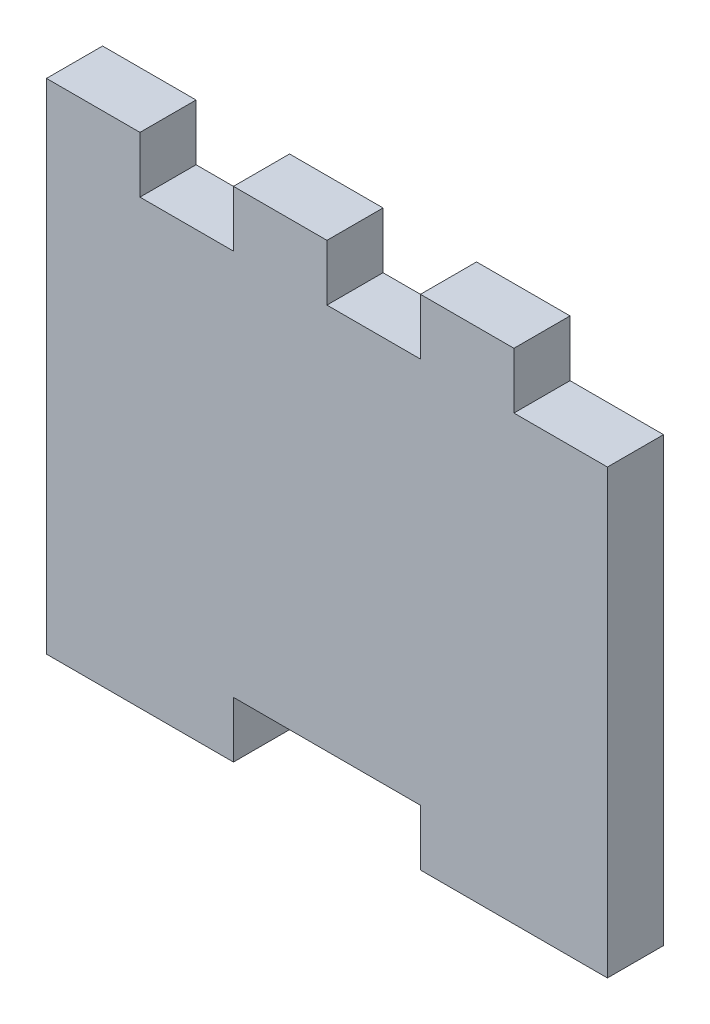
SolidWorks part; units mm, degrees
ref_plane "Спереди" through (0, 0, 0) normal (0, 0, 1) x (1, 0, 0)
ref_plane "Сверху" through (0, 0, 0) normal (0, 1, 0) x (1, 0, 0)
ref_plane "Справа" through (0, 0, 0) normal (1, 0, 0) x (0, 0, -1)
sketch "Эскиз1" plane through (0, 0, 0) normal (0, 0, 1) x (1, 0, 0)
  line L0 (-141.6213, 98.526) -> (-141.6213, 178.526)
  line L1 (-51.6213, 98.526) -> (-51.6213, 169.526)
  line L2 (-141.6213, 178.526) -> (-126.6213, 178.526)
  line L3 (-141.6213, 98.526) -> (-111.6213, 98.526)
  line L4 (-111.6213, 98.526) -> (-111.6213, 107.526)
  line L5 (-111.6213, 107.526) -> (-81.6213, 107.526)
  line L6 (-81.6213, 107.526) -> (-81.6213, 98.526)
  line L7 (-81.6213, 98.526) -> (-51.6213, 98.526)
  line L8 (-126.6213, 178.526) -> (-126.6213, 169.526)
  line L9 (-126.6213, 169.526) -> (-111.6213, 169.526)
  line L10 (-111.6213, 169.526) -> (-111.6213, 178.526)
  line L11 (-111.6213, 178.526) -> (-96.6213, 178.526)
  line L12 (-96.6213, 178.526) -> (-96.6213, 169.526)
  line L13 (-96.6213, 169.526) -> (-81.6213, 169.526)
  line L14 (-81.6213, 169.526) -> (-81.6213, 178.526)
  line L15 (-81.6213, 178.526) -> (-66.6213, 178.526)
  line L16 (-66.6213, 178.526) -> (-66.6213, 169.526)
  line L17 (-66.6213, 169.526) -> (-51.6213, 169.526)
extrude "Бобышка-Вытянуть1" add sketch "Эскиз1" along normal blind 9 contours L0 L2 L8 L9 L10 L11 L12 L13 L14 L15 L16 L17 L1 L7 L6 L5 L4 L3
